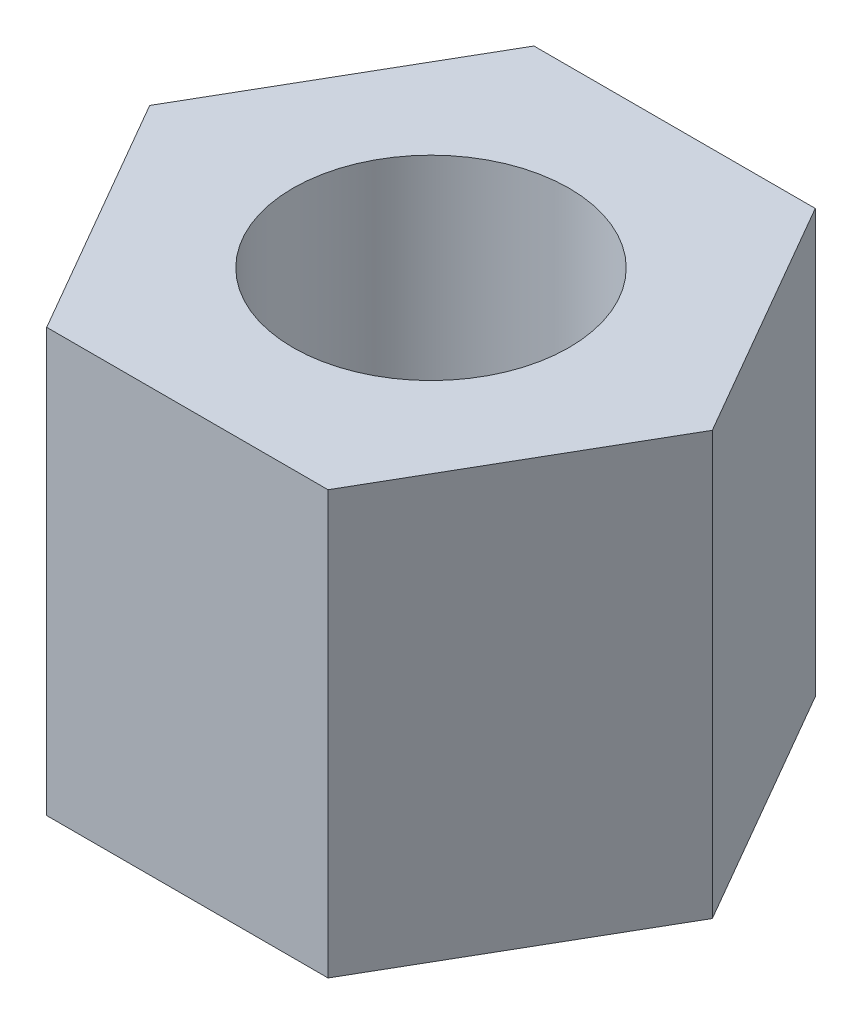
SolidWorks part; units mm, degrees
ref_plane "Front" through (0, 0, 0) normal (0, 0, 1) x (1, 0, 0)
ref_plane "Top" through (0, 0, 0) normal (0, 1, 0) x (1, 0, 0)
ref_plane "Right" through (0, 0, 0) normal (1, 0, 0) x (0, 0, -1)
sketch "Sketch1" plane through (0, 0, 0) normal (0, 1, 0) x (1, 0, 0)
  line L1 (3.4641, 6) -> (-3.4641, 6)
  line L2 (-3.4641, 6) -> (-6.9282, 0)
  line L3 (-6.9282, 0) -> (-3.4641, -6)
  line L4 (-3.4641, -6) -> (3.4641, -6)
  line L5 (3.4641, -6) -> (6.9282, 0)
  line L6 (6.9282, 0) -> (3.4641, 6)
  circle A0 centre (0, 0) radius 6 construction
  dimension "D1" = 12
extrude "Extrude1" add sketch "Sketch1" along normal blind 10.414
hole_wizard "M8x1.25 Tapped Hole1" positions "Sketch3" profile "Sketch2" tap size "M8x1.25" standard "Ansi Metric"
sketch "Sketch3" plane through (0, 10.414, 0) normal (0, 1, 0) x (-1, 0, 0)
  point P0 (0, 0)
sketch "Sketch2" plane through (0, 10.414, 0) normal (1, 0, 0) x (0, 0, 1)
  line L0 (0, 0) -> (0, 10.414)
  line L1 (0, 10.414) -> (3.4, 10.414)
  line L2 (3.4, 10.414) -> (3.4, 0)
  line L5 (3.4, 0) -> (0, 0)
  line L11 (0, -6.35) -> (0, 107.95) construction
  dimension "Thru Tap Drill Dia." = 6.8
  dimension "Thru Tap Drill Depth" = 10.414
